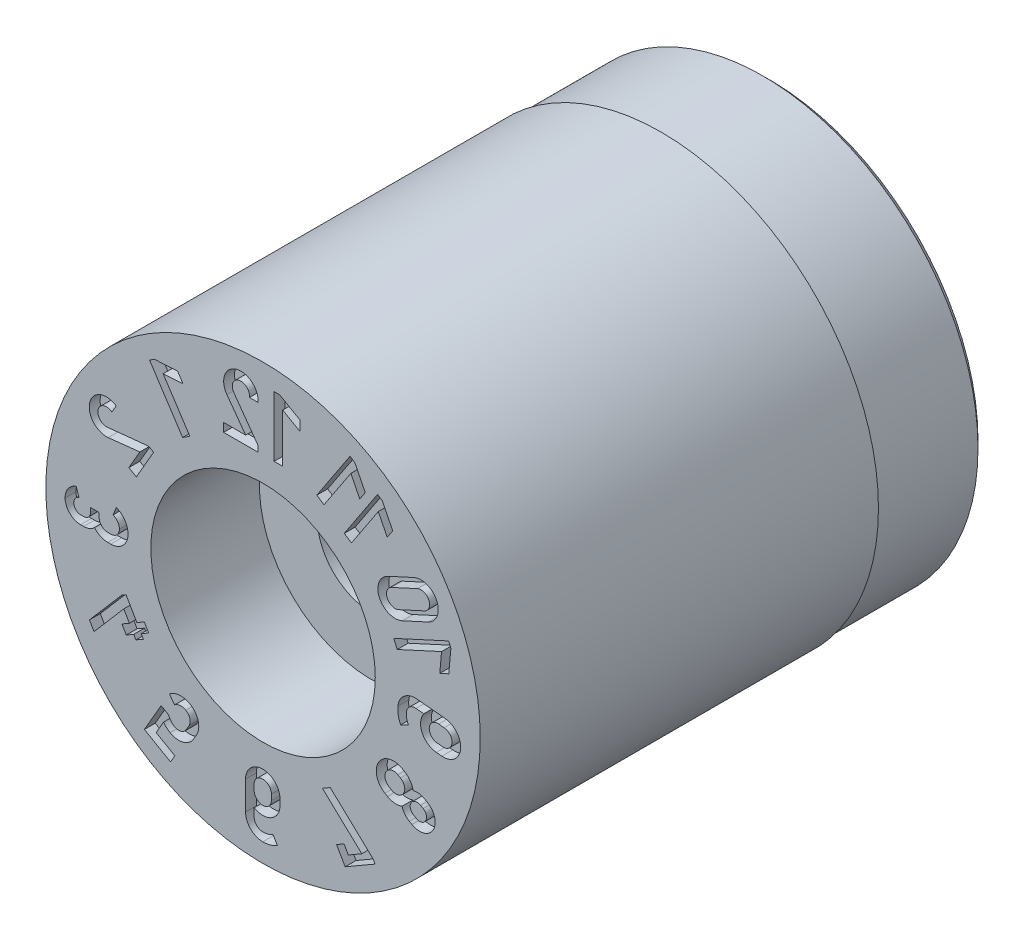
SolidWorks part; units mm, degrees
ref_plane "Front Plane" through (0, 0, 0) normal (0, 0, 1) x (1, 0, 0)
ref_plane "Top Plane" through (0, 0, 0) normal (0, 1, 0) x (1, 0, 0)
ref_plane "Right Plane" through (0, 0, 0) normal (1, 0, 0) x (0, 0, -1)
sketch "Sketch1" plane through (0, 0, 0) normal (1, 0, 0) x (0, 0, -1)
  line L2 (0, 6) -> (0, 3.1)
  line L3 (13.75, 6) -> (0, 6)
  line L4 (-3.7979, 0) -> (49996.2021, 0) construction
  line L8 (14, 1.5) -> (3, 1.5)
  line L9 (3, 3.1) -> (3, 1.5)
  line L10 (3, 3.1) -> (0, 3.1)
  line L12 (14, 1.5) -> (14, 5.75)
  line L16 (14, 5.75) -> (13.75, 6)
  dimension "D1" = 14
  dimension "D2" = 45
  dimension "D3" = 0.25
  dimension "D4" = 12
  dimension "D5" = 6.2
  dimension "D6" = 3
  dimension "D7" = 3
revolve "Revolve1" add sketch "Sketch1" angle 360 about L4
sketch "Sketch4" plane through (0, 0, 0) normal (1, 0, 0) x (0, 0, -1)
  line L0 (0, 0) -> (50000, 0) construction
  line L1 (14, -5.75) -> (14, 5.75) construction
  line L2 (11, 6.935) -> (14, 6.935)
  line L3 (11, 6.935) -> (11, 5.935)
  line L4 (11, 5.935) -> (14, 5.935)
  line L5 (14, 6.935) -> (14, 5.935)
  line L6 (13.75, 6) -> (0, 6) construction
  line L9 (0, 6.6) -> (0, -6.6) construction
  dimension "D1" = 1
  dimension "D2" = 0.065
  dimension "D3" = 11
revolve "Cut-Revolve1" cut sketch "Sketch4" angle 360 about L0
sketch "Sketch2" plane through (0, 0, 0) normal (0, 0, 1) x (1, 0, 0)
  line L844 (3.163, 4.4141) -> (3.2938, 4.3276)
  line L845 (3.2938, 4.3276) -> (3.5823, 3.7524)
  line L846 (3.5823, 3.7524) -> (3.4308, 3.5232)
  line L847 (3.4308, 3.5232) -> (3.1843, 4.0144)
  line L848 (3.1843, 4.0144) -> (2.4422, 2.8916)
  line L849 (2.4422, 2.8916) -> (2.2435, 3.023)
  line L850 (2.2435, 3.023) -> (3.163, 4.4141)
  line L851 (2.4044, 4.9491) -> (2.5352, 4.8626)
  line L852 (2.5352, 4.8626) -> (2.8237, 4.2875)
  line L853 (2.8237, 4.2875) -> (2.6722, 4.0583)
  line L854 (2.6722, 4.0583) -> (2.4258, 4.5495)
  line L855 (2.4258, 4.5495) -> (1.6837, 3.4267)
  line L856 (1.6837, 3.4267) -> (1.485, 3.558)
  line L857 (1.485, 3.558) -> (2.4044, 4.9491)
  line L858 (3.7483, 1.9495) -> (4.4627, 2.2776)
  line L859 (4.2638, 2.7106) -> (3.5494, 2.3825)
  line L860 (5.0054, -0.248) -> (4.8513, -0.2337)
  line L861 (4.807, -0.708) -> (4.9611, -0.7224)
  line L862 (5.0276, -0.0108) -> (4.2448, 0.0621)
  line L863 (3.8004, -0.7816) -> (4.0155, -0.6782)
  line L864 (4.9387, -0.9595) -> (4.7848, -0.9457)
  line L865 (4.4404, -0.1953) -> (4.2227, -0.175)
  line L866 (4.1592, -2.7587) -> (4.2314, -2.8003)
  line L867 (4.4219, -2.4702) -> (4.3498, -2.4285)
  line L868 (1.6415, -3.3774) -> (1.8568, -3.2531)
  line L869 (1.8568, -3.2531) -> (3.0369, -4.3652)
  line L870 (3.0369, -4.3652) -> (3.0941, -4.4642)
  line L871 (3.0941, -4.4642) -> (2.2689, -4.9407)
  line L872 (2.2689, -4.9407) -> (2.0307, -4.5281)
  line L873 (2.0307, -4.5281) -> (2.237, -4.4089)
  line L874 (2.237, -4.4089) -> (2.3561, -4.6152)
  line L875 (2.3561, -4.6152) -> (2.7274, -4.4008)
  line L876 (2.7274, -4.4008) -> (1.6415, -3.3774)
  line L877 (3.4855, -2.4247) -> (3.5578, -2.4664)
  line L878 (3.7959, -2.0538) -> (3.7238, -2.012)
  line L879 (3.915, -1.8475) -> (3.8429, -1.8057)
  line L880 (3.3665, -2.631) -> (3.4386, -2.6726)
  line L881 (4.0401, -2.965) -> (4.1123, -3.0066)
  line L882 (4.5409, -2.2641) -> (4.4689, -2.2222)
  line L883 (5.124, 1.8895) -> (5.1895, 1.747)
  line L884 (5.1895, 1.747) -> (5.1308, 1.1062)
  line L885 (5.1308, 1.1062) -> (4.8812, 0.9916)
  line L886 (4.8812, 0.9916) -> (4.9312, 1.5388)
  line L887 (4.9312, 1.5388) -> (3.7081, 0.9771)
  line L888 (3.7081, 0.9771) -> (3.6087, 1.1935)
  line L889 (3.6087, 1.1935) -> (5.124, 1.8895)
  line L890 (4.1644, 2.9271) -> (3.45, 2.599)
  line L891 (3.8477, 1.733) -> (4.5621, 2.0611)
  line L892 (0.3049, 5.4442) -> (0.4618, 5.4442)
  line L893 (0.4618, 5.4442) -> (1.0196, 5.1234)
  line L894 (1.0196, 5.1234) -> (1.0196, 4.8487)
  line L895 (1.0196, 4.8487) -> (0.5431, 5.1225)
  line L896 (0.5431, 5.1225) -> (0.5431, 3.7767)
  line L897 (0.5431, 3.7767) -> (0.3049, 3.7767)
  line L898 (0.3049, 3.7767) -> (0.3049, 5.4442)
  line L899 (-1.0878, 3.773) -> (-0.1349, 3.773)
  line L900 (-0.1349, 3.773) -> (-0.1349, 3.9306)
  line L901 (-0.1349, 3.9306) -> (-0.8048, 4.8606)
  line L902 (-0.3758, 4.9641) -> (-0.1363, 4.9641)
  line L903 (-0.9984, 4.7211) -> (-0.4803, 4.0113)
  line L904 (-0.4803, 4.0113) -> (-1.0878, 4.0113)
  line L905 (-1.0878, 4.0113) -> (-1.0878, 3.773)
  line L906 (-3.1349, 4.4789) -> (-3.0037, 4.5648)
  line L907 (-3.0037, 4.5648) -> (-2.3614, 4.6019)
  line L908 (-2.3614, 4.6019) -> (-2.2109, 4.372)
  line L909 (-2.2109, 4.372) -> (-2.7595, 4.3402)
  line L910 (-2.7595, 4.3402) -> (-2.0225, 3.2141)
  line L911 (-2.0225, 3.2141) -> (-2.2217, 3.0837)
  line L912 (-2.2217, 3.0837) -> (-3.1349, 4.4789)
  line L913 (-0.2457, -4.2186) -> (-0.2457, -4.3734)
  line L914 (0.2307, -4.3734) -> (0.2307, -4.2186)
  line L915 (0.4688, -4.2189) -> (0.4693, -4.3734)
  line L916 (-0.2457, -4.7861) -> (-0.2457, -5.0047)
  line L917 (-0.4841, -4.2186) -> (-0.4839, -5.0047)
  line L918 (0.3975, -5.3688) -> (0.2745, -5.1643)
  line L919 (-2.7487, -3.9885) -> (-2.9522, -4.341)
  line L920 (-2.9522, -4.341) -> (-2.4365, -4.6388)
  line L921 (-2.4365, -4.6388) -> (-2.5556, -4.8451)
  line L922 (-2.5556, -4.8451) -> (-3.2776, -4.4283)
  line L923 (-3.2776, -4.4283) -> (-2.8153, -3.6274)
  line L924 (-2.8153, -3.6274) -> (-2.609, -3.7465)
  line L925 (-2.1228, -3.8572) -> (-2.0454, -3.7231)
  line L926 (-2.44, -3.4205) -> (-2.5883, -3.2339)
  line L927 (-1.8391, -3.8422) -> (-1.9166, -3.9762)
  line L928 (-4.2056, -0.2208) -> (-4.289, -0.2208)
  line L929 (-4.5271, 0.0174) -> (-4.5271, 0.1364)
  line L930 (-4.5271, 0.1364) -> (-4.7654, 0.1364)
  line L931 (-4.7654, 0.1364) -> (-4.7654, 0.0174)
  line L932 (-4.956, -0.1732) -> (-5.0393, -0.1732)
  line L933 (-5.0842, 0.2205) -> (-5.1604, 0.4462)
  line L934 (-5.0393, -0.4114) -> (-4.956, -0.4114)
  line L935 (-4.289, -0.459) -> (-4.2056, -0.459)
  line L936 (-4.0534, 0.4938) -> (-4.1408, 0.2723)
  line L937 (-4.7953, -2.566) -> (-4.6691, -2.7845)
  line L938 (-4.6691, -2.7845) -> (-3.8461, -1.828)
  line L939 (-3.8461, -1.828) -> (-3.6918, -2.0953)
  line L940 (-3.6918, -2.0953) -> (-3.898, -2.2144)
  line L941 (-3.898, -2.2144) -> (-3.7789, -2.4206)
  line L942 (-3.7789, -2.4206) -> (-3.5727, -2.3015)
  line L943 (-3.5727, -2.3015) -> (-3.5131, -2.4047)
  line L944 (-3.5131, -2.4047) -> (-3.3068, -2.2856)
  line L945 (-3.3068, -2.2856) -> (-3.3664, -2.1824)
  line L946 (-3.3664, -2.1824) -> (-3.1601, -2.0633)
  line L947 (-3.1601, -2.0633) -> (-3.2791, -1.857)
  line L948 (-3.2791, -1.857) -> (-3.4855, -1.9762)
  line L949 (-3.4855, -1.9762) -> (-3.7833, -1.4604)
  line L950 (-3.7833, -1.4604) -> (-3.9039, -1.53)
  line L951 (-3.9039, -1.53) -> (-4.7953, -2.566)
  line L952 (-3.7069, 1.6207) -> (-3.5005, 1.5016)
  line L953 (-3.5005, 1.5016) -> (-3.0241, 2.3268)
  line L954 (-3.0241, 2.3268) -> (-3.1605, 2.4055)
  line L955 (-3.1605, 2.4055) -> (-4.3009, 2.2904)
  line L956 (-4.176, 2.7136) -> (-4.0562, 2.9211)
  line L957 (-4.2769, 2.053) -> (-3.4031, 2.1468)
  line L958 (-3.4031, 2.1468) -> (-3.7069, 1.6207)
  arc A408 (3.5494, 2.3825) -> (3.7483, 1.9495) centre (3.6489, 2.166) ccw
  arc A409 (4.4627, 2.2776) -> (4.2638, 2.7106) centre (4.3632, 2.4941) ccw
  arc A410 (4.8513, -0.2337) -> (4.807, -0.708) centre (4.8291, -0.4709) ccw
  arc A411 (4.9611, -0.7224) -> (5.0054, -0.248) centre (4.9833, -0.4852) ccw
  arc A412 (4.2448, 0.0621) -> (3.7262, -0.3679) centre (4.2006, -0.4123) ccw
  arc A413 (3.7262, -0.3679) -> (3.8004, -0.7816) centre (4.5083, -0.4411) ccw
  arc A414 (4.9387, -0.9595) -> (5.0276, -0.0108) centre (4.9831, -0.4851) ccw
  arc A415 (4.4404, -0.1953) -> (4.7848, -0.9457) centre (4.8274, -0.4719) ccw
  arc A416 (4.2227, -0.175) -> (3.9658, -0.3719) centre (4.2005, -0.4121) ccw
  arc A417 (3.9658, -0.3719) -> (4.0155, -0.6782) centre (4.437, -0.4526) ccw
  arc A418 (4.3498, -2.4285) -> (4.1592, -2.7587) centre (4.2542, -2.5934) ccw
  arc A419 (4.2314, -2.8003) -> (4.4219, -2.4702) centre (4.3267, -2.6353) ccw
  arc A420 (3.7238, -2.012) -> (3.4855, -2.4247) centre (3.6047, -2.2184) ccw
  arc A421 (3.5578, -2.4664) -> (3.7959, -2.0538) centre (3.6768, -2.2601) ccw
  arc A422 (4.1463, -2.1786) -> (3.915, -1.8475) centre (3.6768, -2.2601) ccw
  arc A423 (3.8429, -1.8057) -> (3.3665, -2.631) centre (3.6044, -2.2182) ccw
  arc A424 (3.4386, -2.6726) -> (3.841, -2.7073) centre (3.6768, -2.2601) ccw
  arc A425 (3.841, -2.7073) -> (4.0401, -2.965) centre (4.255, -2.5933) ccw
  arc A426 (4.1123, -3.0066) -> (4.5409, -2.2641) centre (4.3266, -2.6353) ccw
  arc A427 (4.4689, -2.2222) -> (4.1463, -2.1786) centre (4.255, -2.5899) ccw
  arc A428 (3.45, 2.599) -> (3.8477, 1.733) centre (3.6489, 2.166) ccw
  arc A429 (4.5621, 2.0611) -> (4.1644, 2.9271) centre (4.3632, 2.4941) ccw
  arc A430 (-0.3758, 4.9641) -> (-0.8048, 4.8606) centre (-0.6114, 4.9998) ccw
  arc A431 (-0.1363, 4.9641) -> (-0.9984, 4.7211) centre (-0.6116, 4.9996) ccw
  arc A432 (-0.2457, -4.3734) -> (0.2307, -4.3734) centre (-0.0075, -4.3734) ccw
  arc A433 (0.2307, -4.2186) -> (-0.2457, -4.2186) centre (-0.0075, -4.2186) ccw
  arc A434 (0.4688, -4.2189) -> (-0.4841, -4.2186) centre (-0.0076, -4.2187) ccw
  arc A435 (-0.2457, -4.7861) -> (0.4693, -4.3734) centre (-0.0063, -4.375) ccw
  arc A436 (-0.2457, -5.0047) -> (-0.0258, -5.2422) centre (-0.0076, -5.0047) ccw
  arc A437 (-0.0258, -5.2422) -> (0.2745, -5.1643) centre (0.0108, -4.7655) ccw
  arc A438 (-0.4839, -5.0047) -> (-0.0075, -5.4811) centre (-0.0074, -5.0046) ccw
  arc A439 (-0.0075, -5.4811) -> (0.3975, -5.3688) centre (-0.0073, -4.6957) ccw
  arc A440 (-2.609, -3.7465) -> (-2.4482, -3.9444) centre (-2.2693, -3.6348) ccw
  arc A441 (-2.4482, -3.9444) -> (-2.1228, -3.8572) centre (-2.3291, -3.7383) ccw
  arc A442 (-2.0454, -3.7231) -> (-2.1326, -3.3977) centre (-2.2515, -3.604) ccw
  arc A443 (-2.1326, -3.3977) -> (-2.44, -3.4205) centre (-2.2695, -3.6352) ccw
  arc A444 (-2.0135, -3.1914) -> (-2.5883, -3.2339) centre (-2.2697, -3.6345) ccw
  arc A445 (-1.8391, -3.8422) -> (-2.0135, -3.1914) centre (-2.2521, -3.6041) ccw
  arc A446 (-2.5673, -4.1507) -> (-1.9166, -3.9762) centre (-2.3295, -3.7371) ccw
  arc A447 (-2.7487, -3.9885) -> (-2.5673, -4.1507) centre (-2.2729, -3.6387) ccw
  arc A448 (-3.9674, 0.0174) -> (-4.1408, 0.2723) centre (-4.2414, 0.0174) ccw
  arc A449 (-4.2056, -0.2208) -> (-3.9674, 0.0174) centre (-4.2056, 0.0174) ccw
  arc A450 (-4.5271, 0.0174) -> (-4.289, -0.2208) centre (-4.289, 0.0174) ccw
  arc A451 (-4.956, -0.1732) -> (-4.7654, 0.0174) centre (-4.956, 0.0174) ccw
  arc A452 (-5.2299, 0.0174) -> (-5.0393, -0.1732) centre (-5.0392, 0.0176) ccw
  arc A453 (-5.0842, 0.2205) -> (-5.2299, 0.0174) centre (-5.0158, 0.0176) ccw
  arc A454 (-5.1604, 0.4462) -> (-5.4681, 0.0174) centre (-5.0154, 0.0173) ccw
  arc A455 (-5.4681, 0.0174) -> (-5.0393, -0.4114) centre (-5.0394, 0.0173) ccw
  arc A456 (-4.956, -0.4114) -> (-4.6548, -0.2878) centre (-4.956, 0.0172) ccw
  arc A457 (-4.6548, -0.2878) -> (-4.289, -0.459) centre (-4.2891, 0.0172) ccw
  arc A458 (-4.2056, -0.459) -> (-3.7292, 0.0174) centre (-4.2056, 0.0173) ccw
  arc A459 (-3.7292, 0.0174) -> (-4.0534, 0.4938) centre (-4.2415, 0.0173) ccw
  arc A460 (-4.176, 2.7136) -> (-4.3009, 2.2904) centre (-4.3248, 2.5275) ccw
  arc A461 (-4.0562, 2.9211) -> (-4.2769, 2.053) centre (-4.3246, 2.5273) ccw
  point P1650 (0, 0.0092)
  point P1651 (0.0092, 0.0092)
  point P1652 (0.0092, 0)
extrude "Cut-Extrude1" cut sketch "Sketch2" against normal blind 0.3
